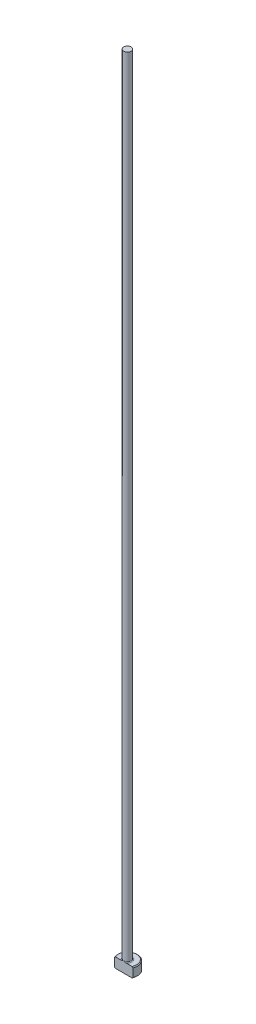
SolidWorks part; units mm, degrees
ref_plane "Front Plane" through (0, 0, 0) normal (0, 0, 1) x (1, 0, 0)
ref_plane "Top Plane" through (0, 0, 0) normal (0, 1, 0) x (1, 0, 0)
ref_plane "Right Plane" through (0, 0, 0) normal (1, 0, 0) x (0, 0, -1)
sketch "Sketch1" plane through (0, 0, 0) normal (0, 0, 1) x (1, 0, 0)
  line L0 (0, 259.9588) -> (0, -15.1925) construction
  line L1 (0, 0) -> (-3.175, 0)
  line L2 (-3.175, 0) -> (-3.175, 3.175)
  line L3 (-3.175, 3.175) -> (-1.19, 3.175)
  line L4 (-1.19, 3.175) -> (-1.19, 254)
  line L5 (-1.19, 254) -> (0, 254)
  line L6 (0, 254) -> (0, 0)
  dimension "L" = 254
  dimension "H" = 6.35
  dimension "T" = 3.175
  dimension "D" = 2.38
revolve "Revolve1" add sketch "Sketch1" angle 360 about L0
chamfer "Chamfer1" distance 0.254 angle 45 2 edges at (0, 3.175, 3.175) (0, 0, 3.175)
fillet "Fillet1" radius 0.254 1 edges at (0, 3.175, 1.19)
sketch "Sketch2" plane through (0, 0, 0) normal (0, 1, 0) x (1, 0, 0)
  line L0 (-2.9436, -1.19) -> (2.9436, -1.19)
  circle A0 centre (0, 0) radius 3.175 construction
  arc A1 (-2.9436, -1.19) -> (2.9436, -1.19) centre (0, 0) ccw
  circle A3 centre (0, 0) radius 1.19 construction
  dimension "D1" = 0
extrude "Key" cut sketch "Sketch2" along normal through all
sketch "Pocket Sketch" plane through (0, 0, 0) normal (0, 0, 1) x (1, 0, 0)
  line L0 (-3.5719, 0) -> (-3.5719, 3.2004)
  line L1 (-3.5719, 3.2004) -> (-2.1504, 3.2004)
  line L2 (-1.3884, 3.9624) -> (-1.3884, 22.225)
  line L3 (-1.3884, 22.225) -> (0, 22.225)
  line L4 (0, 22.225) -> (0, 0)
  line L5 (0, 0) -> (-3.5719, 0)
  line L6 (0, 12.6104) -> (0, -2.4989) construction
  line L7 (-3.175, 2.921) -> (-3.175, 0.254) construction
  line L8 (2.921, 3.175) -> (-2.921, 3.175) construction
  line L9 (-1.19, 254) -> (-1.19, 3.429) construction
  line L10 (-2.1504, 3.2004) -> (-1.3884, 3.9624)
  point P3 (-1.3884, 3.2004)
  dimension "D1" = 7.1437
  dimension "D2" = 0.3969
  dimension "D3" = 0.0254
  dimension "D4" = 0.1984
  dimension "D5" = 2.7769
  dimension "D6" = 22.225
